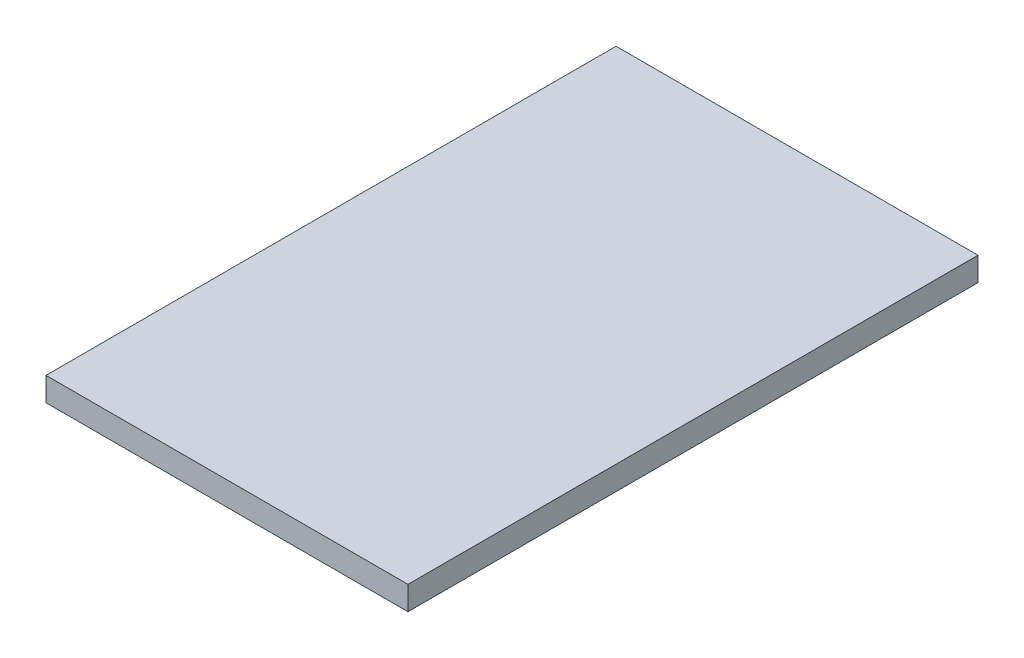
SolidWorks part; units mm, degrees
ref_plane "Front Plane" through (0, 0, 0) normal (0, 0, 1) x (1, 0, 0)
ref_plane "Top Plane" through (0, 0, 0) normal (0, 1, 0) x (1, 0, 0)
ref_plane "Right Plane" through (0, 0, 0) normal (1, 0, 0) x (0, 0, -1)
sketch "Sketch1" plane through (0, 0, 0) normal (0, 1, 0) x (1, 0, 0)
  line L1 (38.1, -60) -> (-38.1, -60)
  line L2 (38.1, -60) -> (38.1, 60)
  line L3 (38.1, 60) -> (-38.1, 60)
  line L4 (-38.1, -60) -> (-38.1, 60)
  line L5 (38.1, -60) -> (-38.1, 60) construction
  line L6 (38.1, 60) -> (-38.1, -60) construction
  point P0 (0, 0)
  dimension "D1" = 120
  dimension "D2" = 76.2
extrude "Boss-Extrude1" add sketch "Sketch1" along normal blind 5
